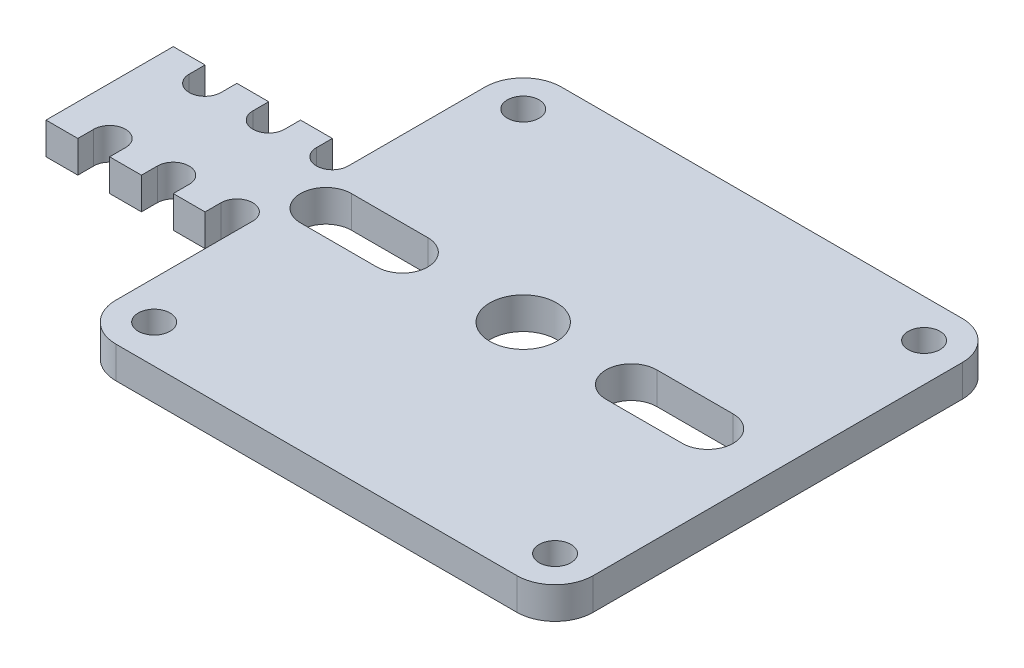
SolidWorks part; units mm, degrees
ref_plane "Front" through (0, 0, 0) normal (0, 0, 1) x (1, 0, 0)
ref_plane "Top" through (0, 0, 0) normal (0, 1, 0) x (1, 0, 0)
ref_plane "Right" through (0, 0, 0) normal (1, 0, 0) x (0, 0, -1)
sketch "Sketch1" plane through (0, 0, 0) normal (0, 1, 0) x (1, 0, 0)
  line L0 (30, 6) -> (30, 27.5)
  line L1 (36, 0) -> (99, 0)
  line L2 (0, 25) -> (0, 45)
  line L3 (36, 70) -> (99, 70)
  line L4 (105, 6) -> (105, 64)
  line L5 (30, 42.5) -> (30, 64)
  line L6 (30, 0) -> (30, 70) construction
  line L7 (34, 31) -> (46, 31)
  line L8 (0, 25) -> (5, 25)
  line L9 (0, 45) -> (5, 45)
  line L10 (105, 0) -> (105, 70) construction
  line L12 (20, 25) -> (25, 25)
  line L13 (5, 42.5) -> (5, 45)
  line L14 (10, 42.5) -> (10, 45)
  line L15 (15, 42.5) -> (15, 45)
  line L16 (20, 42.5) -> (20, 45)
  line L17 (25, 42.5) -> (25, 45)
  line L18 (5, 27.5) -> (5, 25)
  line L19 (10, 27.5) -> (10, 25)
  line L20 (15, 27.5) -> (15, 25)
  line L21 (20, 27.5) -> (20, 25)
  line L22 (25, 27.5) -> (25, 25)
  line L23 (10, 45) -> (15, 45)
  line L25 (10, 25) -> (15, 25)
  line L26 (82, 31) -> (94, 31)
  line L27 (20, 45) -> (25, 45)
  line L29 (82, 39) -> (94, 39)
  line L30 (34, 39) -> (46, 39)
  circle A0 centre (36, 64) radius 2.5
  circle A1 centre (99, 64) radius 2.5
  circle A2 centre (99, 6) radius 2.5
  circle A3 centre (36, 6) radius 2.5
  arc A4 (5, 42.5) -> (10, 42.5) centre (7.5, 42.5) ccw
  arc A5 (15, 42.5) -> (20, 42.5) centre (17.5, 42.5) ccw
  arc A6 (25, 42.5) -> (30, 42.5) centre (27.5, 42.5) ccw
  arc A7 (10, 27.5) -> (5, 27.5) centre (7.5, 27.5) ccw
  arc A8 (20, 27.5) -> (15, 27.5) centre (17.5, 27.5) ccw
  arc A9 (30, 27.5) -> (25, 27.5) centre (27.5, 27.5) ccw
  arc A10 (46, 31) -> (46, 39) centre (46, 35) ccw
  arc A11 (34, 39) -> (34, 31) centre (34, 35) ccw
  circle A12 centre (65, 35) radius 5.25
  arc A13 (94, 31) -> (94, 39) centre (94, 35) ccw
  arc A14 (82, 39) -> (82, 31) centre (82, 35) ccw
  arc A15 (30, 64) -> (36, 70) centre (36, 64) cw
  arc A16 (105, 64) -> (99, 70) centre (99, 64) ccw
  arc A17 (99, 0) -> (105, 6) centre (99, 6) ccw
  arc A18 (36, 0) -> (30, 6) centre (36, 6) cw
extrude "Extrude1" add sketch "Sketch1" along normal blind 5
